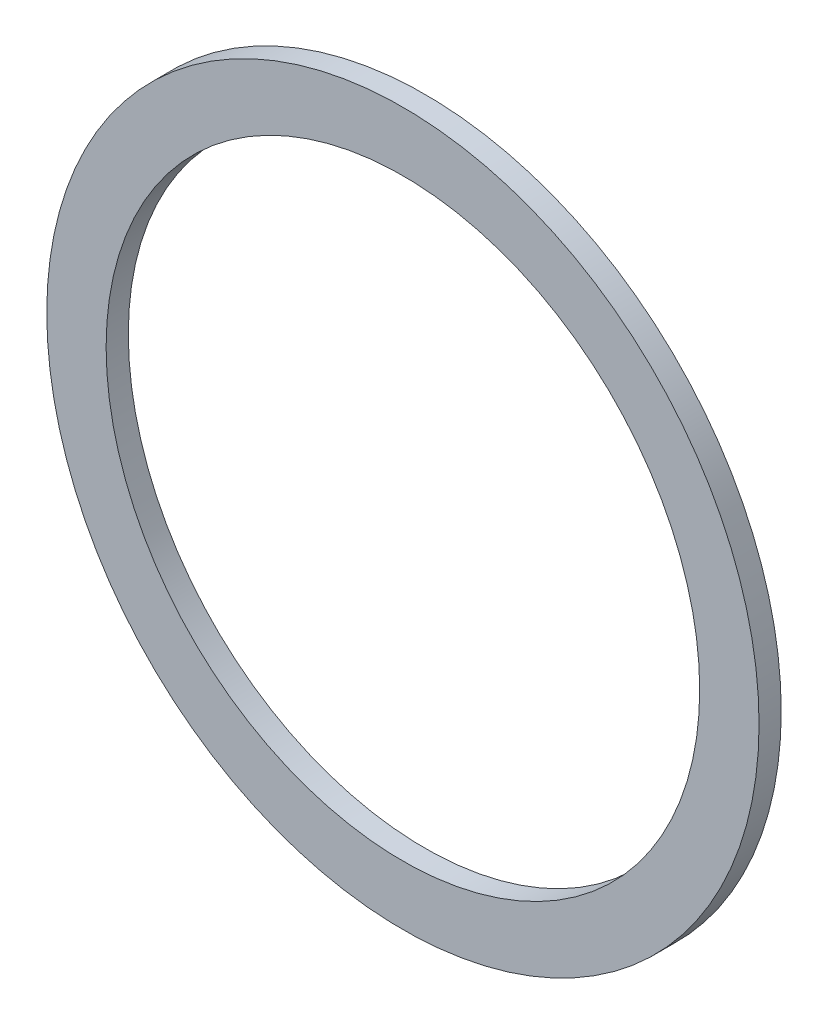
SolidWorks part; units mm, degrees
ref_plane "Front" through (0, 0, 0) normal (0, 0, 1) x (1, 0, 0)
ref_plane "Top" through (0, 0, 0) normal (0, 1, 0) x (1, 0, 0)
ref_plane "Right" through (0, 0, 0) normal (1, 0, 0) x (0, 0, -1)
sketch "Sketch1" plane through (0, 0, 0) normal (0, 0, 1) x (1, 0, 0)
  circle A0 centre (0, 0) radius 10.541
  circle A1 centre (0, 0) radius 12.6492
  dimension "D1" = 25.2984
  dimension "D2" = 21.082
extrude "Extrude1" add sketch "Sketch1" along normal blind 0.7874
